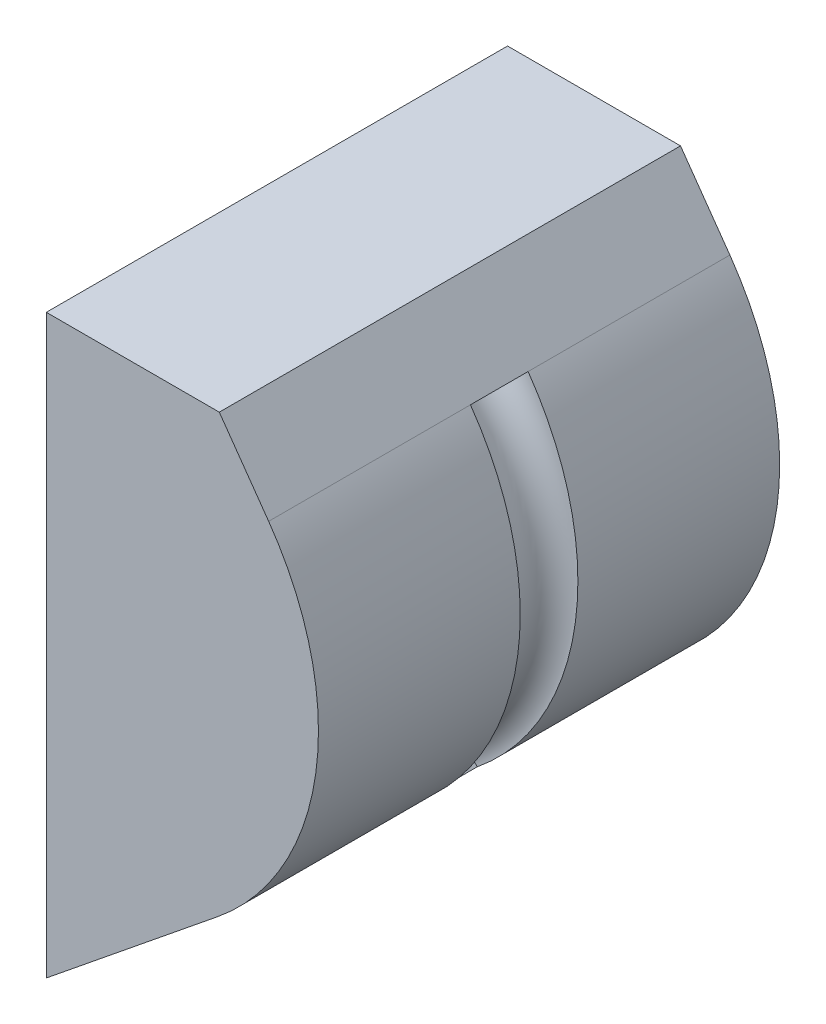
SolidWorks part; units mm, degrees
ref_plane "Front Plane" through (0, 0, 0) normal (0, 0, 1) x (1, 0, 0)
ref_plane "Top Plane" through (0, 0, 0) normal (0, 1, 0) x (1, 0, 0)
ref_plane "Right Plane" through (0, 0, 0) normal (1, 0, 0) x (0, 0, -1)
sketch "Sketch1" plane through (0, 0, 0) normal (0, 0, 1) x (1, 0, 0)
  line L0 (0, 0) -> (30, 0)
  line L1 (30, 0) -> (38.5631, -12.1176)
  line L2 (29.7408, -75.912) -> (0, -100)
  line L3 (0, 0) -> (0, -100)
  arc A0 (38.5631, -12.1176) -> (29.7408, -75.912) centre (0.0911, -39.3045) cw
  dimension "D1" = 47.1086
  dimension "D2" = 30
  dimension "D3" = 100
extrude "Extrude1" add sketch "Sketch1" along normal mid plane 80
sketch "Sketch2" plane through (0, 0, 0) normal (0, 0, 1) x (1, 0, 0)
  arc A1 (29.7408, -75.912) -> (38.5631, -12.1176) centre (0.0911, -39.3045) ccw construction
  arc A2 (29.7408, -75.912) -> (38.5631, -12.1176) centre (0.0911, -39.3045) ccw
ref_plane "Plane1" through (38.5631, -12.1176, 0) normal (-0.5771, 0.8167, 0) x (0, 0, 1)
sketch "Sketch3" plane through (38.5631, -12.1176, 0) normal (-0.5771, 0.8167, 0) x (0, 0, 1)
  circle A0 centre (0, 0) radius 5
  dimension "D1" = 10
sweep "Cut-Sweep1" cut profiles "Sketch3" path "Sketch2"
